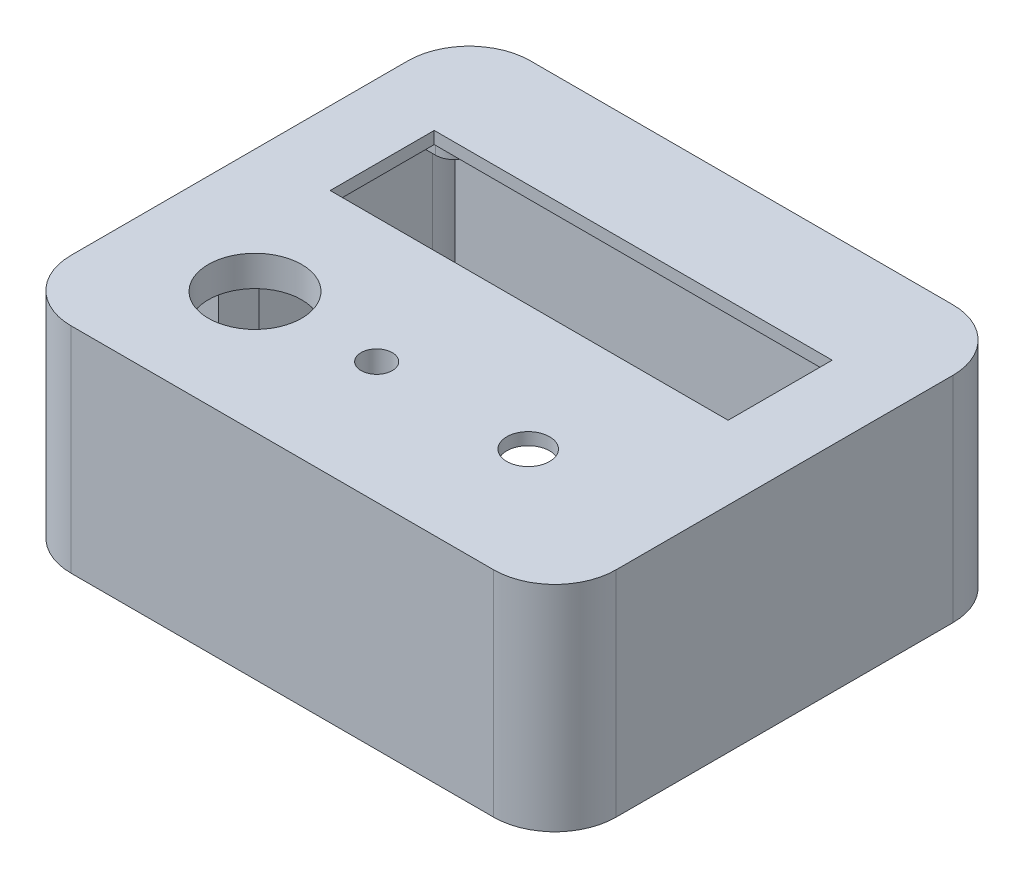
SolidWorks part; units mm, degrees
ref_plane "Front Plane" through (0, 0, 0) normal (0, 0, 1) x (1, 0, 0)
ref_plane "Top Plane" through (0, 0, 0) normal (0, 1, 0) x (1, 0, 0)
ref_plane "Right Plane" through (0, 0, 0) normal (1, 0, 0) x (0, 0, -1)
sketch "Sketch1" plane through (0, 0, 0) normal (0, 1, 0) x (1, 0, 0)
  line L0 (0, 12) -> (0, 13) construction
  line L1 (-32.5, -8.5) -> (32.5, -8.5)
  line L2 (-32.5, -8.5) -> (-32.5, 8.5)
  line L3 (-32.5, 8.5) -> (32.5, 8.5)
  line L4 (32.5, -8.5) -> (32.5, 8.5)
  line L5 (-32.5, -8.5) -> (32.5, 8.5) construction
  line L6 (-32.5, 8.5) -> (32.5, -8.5) construction
  line L15 (0, -12) -> (0, -17.3) construction
  line L21 (-39.5, 18.7) -> (40.5, 18.7)
  line L22 (-39.5, 18.7) -> (-39.5, -17.3)
  line L23 (-39.5, -17.3) -> (40.5, -17.3)
  line L24 (40.5, 18.7) -> (40.5, -17.3)
  line L29 (-36.5, -13) -> (36.5, 13) construction
  line L30 (-36.5, 13) -> (36.5, -13) construction
  point P0 (0, 0)
  point P6 (0, 0)
  point P23 (0, 0)
extrude "Boss-Extrude2" add sketch "Sketch1" along normal blind 2
sketch "Sketch2" plane through (0, 2, 0) normal (0, 1, 0) x (1, 0, 0)
  line L0 (36.5, 0) -> (38, 0) construction
  line L1 (-36.5, -13) -> (36.5, -13)
  line L2 (-36.5, -13) -> (-36.5, 13)
  line L3 (-36.5, 13) -> (36.5, 13)
  line L4 (36.5, -13) -> (36.5, 13)
  line L5 (-36.5, -13) -> (36.5, 13) construction
  line L6 (-36.5, 13) -> (36.5, -13) construction
  line L7 (-38, -14.5) -> (38, -14.5)
  line L8 (-38, -14.5) -> (-38, 14.5)
  line L9 (-38, 14.5) -> (38, 14.5)
  line L10 (38, -14.5) -> (38, 14.5)
  line L11 (-38, -14.5) -> (38, 14.5) construction
  line L12 (-38, 14.5) -> (38, -14.5) construction
  line L13 (0, 13) -> (0, 14.5) construction
  point P0 (0, 0)
  point P6 (0, 0)
extrude "Boss-Extrude3" add sketch "Sketch2" along normal blind 3
sketch "Sketch3" plane through (0, 2, 0) normal (0, 1, 0) x (1, 0, 0)
  circle A0 centre (-37.4, 16.6) radius 1.6
  circle A1 centre (38.4, 16.6) radius 1.6
  circle A2 centre (38.4, -15.2) radius 1.6
  circle A3 centre (-37.4, -15.2) radius 1.6
extrude "Boss-Extrude4" add sketch "Sketch3" along normal blind 0.5 contours A3 M3 M2 | A2 M2 M1 | A1 | A0
sketch "Sketch5" plane through (0, 5, 0) normal (0, 1, 0) x (1, 0, 0)
  line L1 (-38, 14.5) -> (38, 14.5)
  line L2 (-38, 14.5) -> (-38, -14.5)
  line L3 (-38, -14.5) -> (38, -14.5)
  line L4 (38, 14.5) -> (38, -14.5)
  line L5 (-36.5, 13) -> (36.5, 13)
  line L6 (-36.5, 13) -> (-36.5, -13)
  line L7 (-36.5, -13) -> (36.5, -13)
  line L8 (36.5, 13) -> (36.5, -13)
extrude "Boss-Extrude5" add sketch "Sketch5" against normal blind 8
sketch "Sketch7" plane through (0, 2.5, 0) normal (0, 1, 0) x (1, 0, 0)
  circle A0 centre (-37.4, 16.6) radius 1.6
  circle A1 centre (-37.4, -15.2) radius 1.6
  circle A2 centre (38.4, -15.2) radius 1.6
  circle A3 centre (38.4, 16.6) radius 1.6
extrude "Boss-Extrude7" add sketch "Sketch7" against normal blind 3
sketch "Sketch8" plane through (0, 2, 0) normal (0, 1, 0) x (1, 0, 0)
  line L1 (-39.5, 18.7) -> (40.5, 18.7)
  line L2 (-39.5, 18.7) -> (-39.5, -17.3)
  line L3 (-39.5, -17.3) -> (40.5, -17.3)
  line L4 (40.5, 18.7) -> (40.5, -17.3)
extrude "Cut-Extrude3" cut sketch "Sketch8" along normal blind 75
sketch "Sketch9" plane through (0, 2, 0) normal (0, 1, 0) x (1, 0, 0)
  line L0 (-32.5, 8.5) -> (32.5, -8.5) construction
  line L1 (32.5, -8.5) -> (35.5526, -9.2984) construction
  line L2 (-40.5, 0) -> (-42, 0) construction
  line L3 (-40.5, -18.7) -> (40.5, -18.7)
  line L4 (-40.5, -18.7) -> (-40.5, 18.7)
  line L5 (-40.5, 18.7) -> (40.5, 18.7)
  line L6 (40.5, -18.7) -> (40.5, 18.7)
  line L7 (-40.5, -18.7) -> (40.5, 18.7) construction
  line L8 (-40.5, 18.7) -> (40.5, -18.7) construction
  line L9 (40.5, 0) -> (42, 0) construction
  line L10 (0, 18.7) -> (0, 23.7) construction
  line L11 (-42, -11.3) -> (-44.5, -11.3) construction
  line L12 (-42, 23.7) -> (42, 23.7)
  line L13 (-42, 23.7) -> (-42, -46.3)
  line L14 (-42, -46.3) -> (42, -46.3)
  line L15 (42, 23.7) -> (42, -46.3)
  line L16 (42, -11.3) -> (44.5, -11.3) construction
  line L17 (0, 23.7) -> (0, 26.2) construction
  line L18 (0, -46.3) -> (0, -48.8) construction
  line L20 (-44.5, 26.2) -> (44.5, 26.2)
  line L21 (-44.5, 26.2) -> (-44.5, -48.8)
  line L22 (-44.5, -48.8) -> (44.5, -48.8)
  line L23 (44.5, 26.2) -> (44.5, -48.8)
  point P5 (0, 0)
extrude "Boss-Extrude8" add sketch "Sketch9" against normal blind 35 separate body contours L23 L20 L21 L22 L12 L15 L14 L13
fillet "Fillet2" radius 7 4 edges at (-42, -15.5, 46.3) (42, -15.5, 46.3) (42, -15.5, -23.7) (-42, -15.5, -23.7)
fillet "Fillet3" radius 10 4 edges at (-44.5, -15.5, 48.8) (44.5, -15.5, 48.8) (44.5, -15.5, -26.2) (-44.5, -15.5, -26.2)
sketch "Sketch10" plane through (0, 2, 0) normal (0, 1, 0) x (1, 0, 0)
  line L0 (-35, 23.7) -> (35, 23.7)
  line L1 (-42, 16.7) -> (-42, -39.3)
  line L2 (-35, -46.3) -> (35, -46.3)
  line L3 (42, 16.7) -> (42, -39.3)
  line L5 (-32.5, 8.5) -> (32.5, 8.5)
  line L6 (-32.5, 8.5) -> (-32.5, -8.5)
  line L7 (-32.5, -8.5) -> (32.5, -8.5)
  line L8 (32.5, 8.5) -> (32.5, -8.5)
  circle A0 centre (-35, 16.7) radius 7
  circle A1 centre (35, 16.7) radius 7
  circle A2 centre (35, -39.3) radius 7
  circle A3 centre (-35, -39.3) radius 7
extrude "Boss-Extrude10" add sketch "Sketch10" against normal blind 2 contours A3 A2 A1 A0 L5 L8 L7 L6 M16 M14 M12 M10 | A0 M11 | A1 M13 | A2 M15 | A3 M17
sketch "Sketch12" plane through (0, -3, 0) normal (0, -1, 0) x (1, 0, 0)
  line L1 (38, -14.5) -> (-38, -14.5)
  line L2 (38, -14.5) -> (38, 14.5)
  line L3 (38, 14.5) -> (-38, 14.5)
  line L4 (-38, -14.5) -> (-38, 14.5)
extrude "Cut-Extrude4" cut sketch "Sketch12" against normal blind 3
sketch "Sketch13" plane through (0, 0, 0) normal (0, -1, 0) x (-1, 0, 0)
  line L0 (-38.4, 19.6) -> (-41.371, 19.6)
  line L1 (-38.4, 13.6) -> (-42, 13.6)
  line L2 (-42, 16.7) -> (-42, -39.3) construction
  line L3 (37.4, 19.6) -> (41.371, 19.6)
  line L4 (37.4, 13.6) -> (42, 13.6)
  line L5 (42, -39.3) -> (42, 16.7) construction
  line L6 (37.4, -12.2) -> (42, -12.2)
  line L7 (37.4, -18.2) -> (42, -18.2)
  line L8 (-38.4, -12.2) -> (-42, -12.2)
  line L9 (-38.4, -18.2) -> (-42, -18.2)
  circle A0 centre (-38.4, -15.2) radius 1.6
  circle A1 centre (-38.4, 16.6) radius 1.6
  circle A2 centre (37.4, 16.6) radius 1.6
  circle A3 centre (37.4, -15.2) radius 1.6
  circle A4 centre (-38.4, 16.6) radius 3
  circle A5 centre (37.4, 16.6) radius 3
  circle A6 centre (-38.4, -15.2) radius 3
  circle A7 centre (37.4, -15.2) radius 3
  arc A8 (-35, 23.7) -> (-42, 16.7) centre (-35, 16.7) ccw construction
  arc A9 (42, 16.7) -> (35, 23.7) centre (35, 16.7) ccw construction
extrude "Boss-Extrude11" add sketch "Sketch13" along normal blind 6.5 contours A4 M8 | A4 L0 L1 M16 M17 | A5 L4 L3 M13 M14 | A5 M9 | A7 L7 L6 M13 | A7 A3 M6 | A6 A0 M10 | A6 L8 L9 M17
sketch "Sketch14" plane through (0, -6.5, 0) normal (0, -1, 0) x (-1, 0, 0)
  circle A0 centre (-38.4, 16.6) radius 1.6
  circle A1 centre (37.4, 16.6) radius 1.6
  circle A2 centre (37.4, -15.2) radius 1.6
  circle A3 centre (-38.4, -15.2) radius 1.6
extrude "Cut-Extrude5" cut sketch "Sketch14" against normal blind 6.5
sketch "Sketch15" plane through (0, 0, 0) normal (0, -1, 0) x (1, 0, 0)
  line L0 (-37.4, 18.2) -> (38.4, 18.2) construction
  line L1 (20.25, 28.9039) -> (20.25, 46.3) construction
  line L2 (35, 46.3) -> (-35, 46.3) construction
  line L3 (42, 32.25) -> (32, 32.25) construction
  line L4 (42, 18.2) -> (42, 39.3) construction
  line L5 (-42, 32.25) -> (-32, 32.25) construction
  line L6 (-42, 39.3) -> (-42, 18.2) construction
  line L7 (32, 18.2) -> (32, 46.3) construction
  line L8 (-32, 18.2) -> (-32, 46.3) construction
  line L9 (0, 8.5) -> (0, 46.3) construction
  line L10 (-32.5, 8.5) -> (32.5, 8.5) construction
  line L11 (-24.375, 28.9039) -> (-24.375, 46.3) construction
  line L12 (7.75, 28.9039) -> (-16.75, 28.9039) construction
  circle A0 centre (-24.375, 28.9039) radius 7.625
  circle A3 centre (20.25, 28.9039) radius 3.5
  circle A5 centre (-4.5, 28.9039) radius 2.55
sketch "Sketch16" plane through (0, -6.5, 0) normal (0, -1, 0) x (1, 0, 0)
sketch "Sketch17" plane through (0, 2, 0) normal (0, 1, 0) x (1, 0, 0)
extrude "Cut-Extrude6" cut sketch "Sketch15" against normal blind 6.5
sketch "Sketch18" plane through (0, 0, 0) normal (0, -1, 0) x (-1, 0, 0)
  line L0 (37.4, 19.6) -> (-38.4, 19.6)
  line L1 (-35, 23.7) -> (35, 23.7)
  line L2 (-38.4, 19.6) -> (-41.371, 19.6)
  line L3 (37.4, 19.6) -> (41.371, 19.6)
  circle A0 centre (35, 16.7) radius 7
  circle A1 centre (-35, 16.7) radius 7
extrude "Boss-Extrude12" add sketch "Sketch18" along normal blind 30.5 contours L0 A1 M27 M28 | A1 L0 A0 M26 | A0 L0 M25 M24
sketch "Sketch19" plane through (0, 0, 0) normal (0, -1, 0) x (-1, 0, 0)
  line L0 (-38.4, -12.2) -> (-42, -12.2) construction
  line L1 (-42, 13.6) -> (-41, 13.6)
  line L2 (-42, 13.6) -> (-42, -12.2)
  line L3 (-42, -12.2) -> (-41, -12.2)
  line L4 (-41, 13.6) -> (-41, -12.2)
  line L5 (37.4, -12.2) -> (42, -12.2) construction
  line L6 (42, 13.6) -> (41, 13.6)
  line L7 (42, 13.6) -> (42, -12.2)
  line L8 (42, -12.2) -> (41, -12.2)
  line L9 (41, 13.6) -> (41, -12.2)
extrude "Boss-Extrude14" add sketch "Sketch19" along normal blind 30.5
sketch "Sketch20" plane through (0, 0, 0) normal (0, -1, 0) x (-1, 0, 0)
  line L0 (-42, -39.3) -> (42, -39.3)
  line L1 (35, -46.3) -> (-35, -46.3)
  arc A1 (35, -46.3) -> (42, -39.3) centre (35, -39.3) ccw construction
  circle A2 centre (35, -39.3) radius 7
  circle A3 centre (-35, -39.3) radius 7
extrude "Boss-Extrude15" add sketch "Sketch20" along normal blind 30.5 contours L0 A2 M22 | A3 A2 L0 M21 | A3 L0 M20
sketch "Sketch22" plane through (0, 0, 0) normal (0, -1, 0) x (-1, 0, 0)
  line L0 (-42, -39.3) -> (42, -39.3) construction
  line L1 (-42, -18.2) -> (-41, -18.2)
  line L2 (-42, -18.2) -> (-42, -39.3)
  line L3 (-42, -39.3) -> (-41, -39.3)
  line L4 (-41, -18.2) -> (-41, -39.3)
  line L5 (37.4, -18.2) -> (42, -18.2) construction
  line L6 (42, -39.3) -> (41, -39.3)
  line L7 (42, -39.3) -> (42, -18.2)
  line L8 (42, -18.2) -> (41, -18.2)
  line L9 (41, -39.3) -> (41, -18.2)
extrude "Boss-Extrude16" add sketch "Sketch22" along normal blind 30.5
sketch "Sketch23" plane through (0, -30.5, 0) normal (0, -1, 0) x (-1, 0, 0)
  line L1 (-41, -12.2) -> (-42, -12.2)
  line L2 (-41, -12.2) -> (-41, -18.2)
  line L3 (-41, -18.2) -> (-42, -18.2)
  line L4 (-42, -12.2) -> (-42, -18.2)
  line L5 (42, -12.2) -> (41, -12.2)
  line L6 (42, -12.2) -> (42, -18.2)
  line L7 (42, -18.2) -> (41, -18.2)
  line L8 (41, -12.2) -> (41, -18.2)
extrude "Boss-Extrude17" add sketch "Sketch23" against normal blind 24.5 contours L6 L5 L8 L7
sketch "Sketch24" plane through (0, -30.5, 0) normal (0, -1, 0) x (-1, 0, 0)
  line L0 (41, 13.6) -> (41, 19.6)
  line L1 (41.371, 19.6) -> (-41.371, 19.6) construction
  line L2 (-41, 13.6) -> (-41, 19.6)
  line L4 (-41, 19.6) -> (-42, 19.6)
  line L5 (-41, 19.6) -> (-41, 13.6)
  line L6 (-41, 13.6) -> (-42, 13.6)
  line L7 (-42, 19.6) -> (-42, 13.6)
  line L8 (42, 13.6) -> (41, 13.6)
  line L9 (42, 13.6) -> (42, 19.6)
  line L10 (42, 19.6) -> (41, 19.6)
  line L11 (41, 13.6) -> (41, 19.6)
extrude "Boss-Extrude18" add sketch "Sketch24" against normal blind 26.5 contours L9 L10 L0 M2 | L4 L7 L6 L2
sketch "Sketch25" plane through (0, -30.5, 0) normal (0, -1, 0) x (-1, 0, 0)
  line L1 (-41, -12.2) -> (-42, -12.2)
  line L2 (-41, -12.2) -> (-41, -18.2)
  line L3 (-41, -18.2) -> (-42, -18.2)
  line L4 (-42, -12.2) -> (-42, -18.2)
extrude "Boss-Extrude19" add sketch "Sketch25" against normal blind 24.5
sketch "Sketch27" plane through (0, -30.5, 0) normal (0, -1, 0) x (-1, 0, 0)
  line L0 (0, -46.3) -> (0, -42.2) construction
  line L1 (-35, -46.3) -> (35, -46.3) construction
  line L2 (41.371, -42.2) -> (-41.371, -42.2)
  arc A0 (35, -46.3) -> (42, -39.3) centre (35, -39.3) ccw construction
  arc A1 (-42, -39.3) -> (-35, -46.3) centre (-35, -39.3) ccw construction
  circle A2 centre (35, -39.3) radius 7
  circle A3 centre (35, -39.3) radius 6
  circle A4 centre (-35, -39.3) radius 7
  circle A5 centre (-35, -39.3) radius 6
extrude "Cut-Extrude7" cut sketch "Sketch27" against normal blind 30.5 contours A4 L2 A2 M2 | A5 L2 A4 M2 | A5 L2 M2 | A3 L2 M2 | A3 A2 L2 M2
sketch "Sketch28" plane through (0, -30.5, 0) normal (0, -1, 0) x (-1, 0, 0)
  line L0 (-41, 16.7) -> (-41, 19.6)
  line L1 (-41, 19.6) -> (-40.2526, 19.6)
  line L2 (41, 19.6) -> (-41, 19.6) construction
  line L3 (41, 16.7) -> (41, 19.6)
  line L4 (41, 19.6) -> (27.1652, 19.6)
  circle A0 centre (-35, 16.7) radius 7
  circle A1 centre (-35, 16.7) radius 6
  circle A2 centre (35, 16.7) radius 7
  circle A3 centre (35.2573, 16.7) radius 5.7427
extrude "Boss-Extrude20" add sketch "Sketch28" against normal blind 30.5 contours A1 M6 M5 | A3 L4 M7
sketch "Sketch29" plane through (0, 0, 0) normal (0, -1, 0) x (-1, 0, 0)
  line L0 (34.4, -15.2) -> (34.4, -25.2) construction
  line L2 (41, -18.2) -> (34.4, -18.2)
  line L3 (41, -18.2) -> (41, -24.8)
  line L4 (41, -24.8) -> (34.4, -24.8)
  line L5 (34.4, -18.2) -> (34.4, -24.8)
  line L7 (-41, -18.2) -> (-35.4, -18.2)
  line L8 (-41, -18.2) -> (-41, -24.8)
  line L9 (-41, -24.8) -> (-35.4, -24.8)
  line L10 (-35.4, -18.2) -> (-35.4, -24.8)
  arc A0 (37.4, -12.2) -> (37.4, -18.2) centre (37.4, -15.2) ccw construction
extrude "Boss-Extrude21" add sketch "Sketch29" along normal blind 30.5
sketch "Sketch30" plane through (0, 0, 0) normal (0, -1, 0) x (-1, 0, 0)
  line L0 (-38.4, -18.2) -> (-35.4, -18.2)
  line L1 (-35.4, -18.2) -> (-38.4, -18.2) construction
  line L2 (-35.4, -18.2) -> (-35.4, -15.2)
  line L3 (34.4, -18.2) -> (34.4, -15.2)
  line L4 (34.4, -18.2) -> (37.4, -18.2)
  line L5 (37.4, -18.2) -> (34.4, -18.2) construction
  arc A0 (-38.4, -18.2) -> (-38.4, -12.2) centre (-38.4, -15.2) ccw construction
  circle A1 centre (-38.4, -15.2) radius 3
  arc A2 (37.4, -12.2) -> (37.4, -18.2) centre (37.4, -15.2) ccw construction
  circle A3 centre (37.4, -15.2) radius 3
extrude "Boss-Extrude22" add sketch "Sketch30" along normal blind 6.5 contours L3 M16 M17 | L2 M28 M27
sketch "Sketch31" plane through (0, -30.5, 0) normal (0, -1, 0) x (-1, 0, 0)
  line L0 (41, -24.8) -> (41, -18.2) construction
  line L1 (-41, -24.8) -> (-41, -18.2) construction
  line L2 (-41, -21.5) -> (-35.4, -21.5) construction
  line L3 (-35.4, -24.8) -> (-35.4, -18.2) construction
  line L4 (41, -21.5) -> (38.2, -21.5) construction
  circle A0 centre (-38.2, -21.5) radius 1.4
  circle A1 centre (38.2, -21.5) radius 1.4
extrude "Cut-Extrude8" cut sketch "Sketch31" against normal blind 15
sketch "Sketch32" plane through (0, 0, 0) normal (0, -1, 0) x (-1, 0, 0)
  line L0 (24.375, -21.2789) -> (24.375, -18.7789) construction
  circle A0 centre (24.375, -28.9039) radius 7.625
  circle A1 centre (24.375, -28.9039) radius 10.125
extrude "Boss-Extrude23" add sketch "Sketch32" along normal blind 3
sketch "Sketch33" plane through (0, 0, 0) normal (0, -1, 0) x (-1, 0, 0)
  line L0 (7.05, -28.9039) -> (9.05, -28.9039) construction
  circle A0 centre (4.5, -28.9039) radius 2.55
  circle A1 centre (4.5, -28.9039) radius 4.55
extrude "Boss-Extrude24" add sketch "Sketch33" along normal blind 4.5
